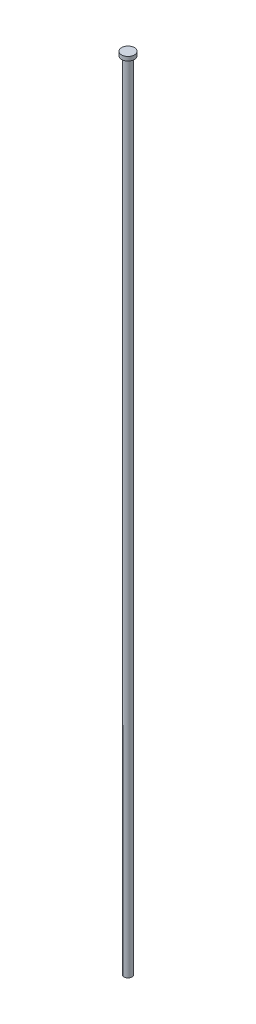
SolidWorks part; units mm, degrees
ref_plane "Front Plane" through (0, 0, 0) normal (0, 0, 1) x (1, 0, 0)
ref_plane "Top Plane" through (0, 0, 0) normal (0, 1, 0) x (1, 0, 0)
ref_plane "Right Plane" through (0, 0, 0) normal (1, 0, 0) x (0, 0, -1)
sketch "PinDia" plane through (0, 0, 0) normal (0, 1, 0) x (1, 0, 0)
  circle A0 centre (0, 0) radius 5
  dimension "D1" = 10
extrude "Length" add sketch "PinDia" against normal blind 1000
sketch "HeadDia" plane through (0, 0, 0) normal (0, 1, 0) x (1, 0, 0)
  circle A0 centre (0, 0) radius 8
  dimension "D1" = 16
extrude "HeadThickness" add sketch "HeadDia" against normal blind 5
fillet "Fillet1" radius 0.5 1 edges at (0, -5, 5)
